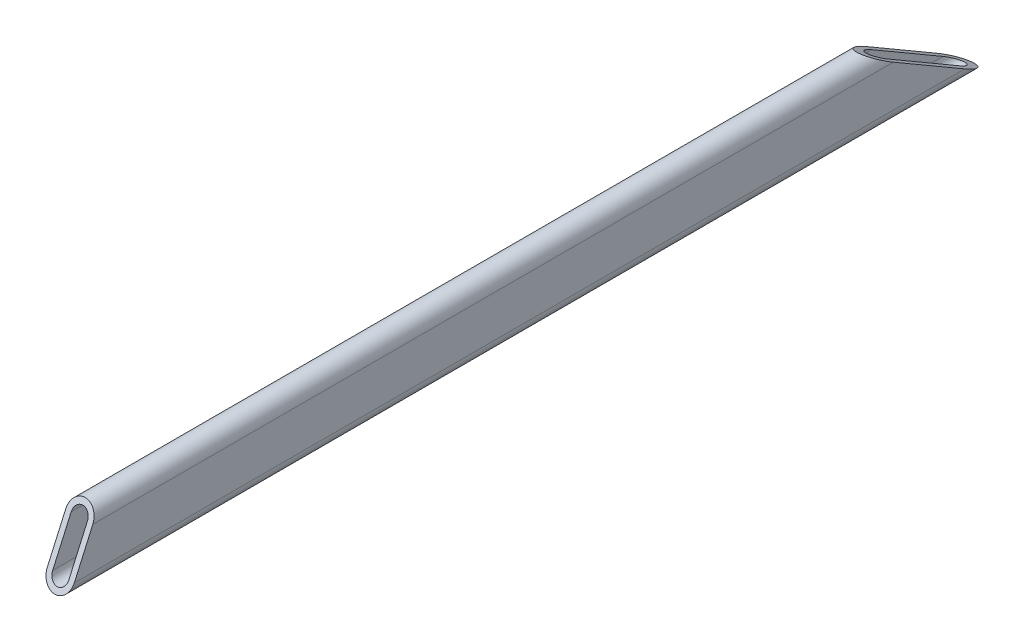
SolidWorks part; units mm, degrees
ref_plane "Plan de face" through (0, 0, 0) normal (0, 0, 1) x (1, 0, 0)
ref_plane "Plan de dessus" through (0, 0, 0) normal (0, 1, 0) x (1, 0, 0)
ref_plane "Plan de droite" through (0, 0, 0) normal (1, 0, 0) x (0, 0, -1)
sketch "Esquisse1" plane through (0, 0, 0) normal (0, 0, 1) x (1, 0, 0)
  line L0 (-7.5, 10.5) -> (-7.5, -12.5)
  line L1 (7.5, 10.5) -> (7.5, -12.5)
  line L2 (4.5, 10.5) -> (4.5, -12.5)
  line L3 (-4.5, 10.5) -> (-4.5, -12.5)
  arc A0 (7.5, 10.5) -> (-7.5, 10.5) centre (0, 10.5) ccw
  arc A1 (-7.5, -12.5) -> (7.5, -12.5) centre (0, -12.5) ccw
  arc A2 (-4.5, -12.5) -> (4.5, -12.5) centre (0, -12.5) ccw
  arc A3 (4.5, 10.5) -> (-4.5, 10.5) centre (0, 10.5) ccw
  dimension "D1" = 15
  dimension "D2" = 23
  dimension "D3" = 12.5
  dimension "D4" = 3
extrude "Extrusion1" add sketch "Esquisse1" along normal mid plane 510
sketch "Esquisse2" plane through (0, 0, 0) normal (1, 0, 0) x (0, 0, -1)
  line L0 (-255, -20) -> (-238.0813, 18)
  line L1 (255, 18) -> (-255, 18) construction
  line L2 (-238.0813, 18) -> (-255, 18)
  line L3 (-255, 18) -> (-255, -20)
  line L4 (255, -20) -> (189.7095, 18)
  line L5 (189.7095, 18) -> (255, 18)
  line L6 (255, 18) -> (255, -20)
  dimension "D1" = 24
  dimension "D2" = 30.2
extrude "Extrusion2" cut sketch "Esquisse2" against normal mid plane 15
